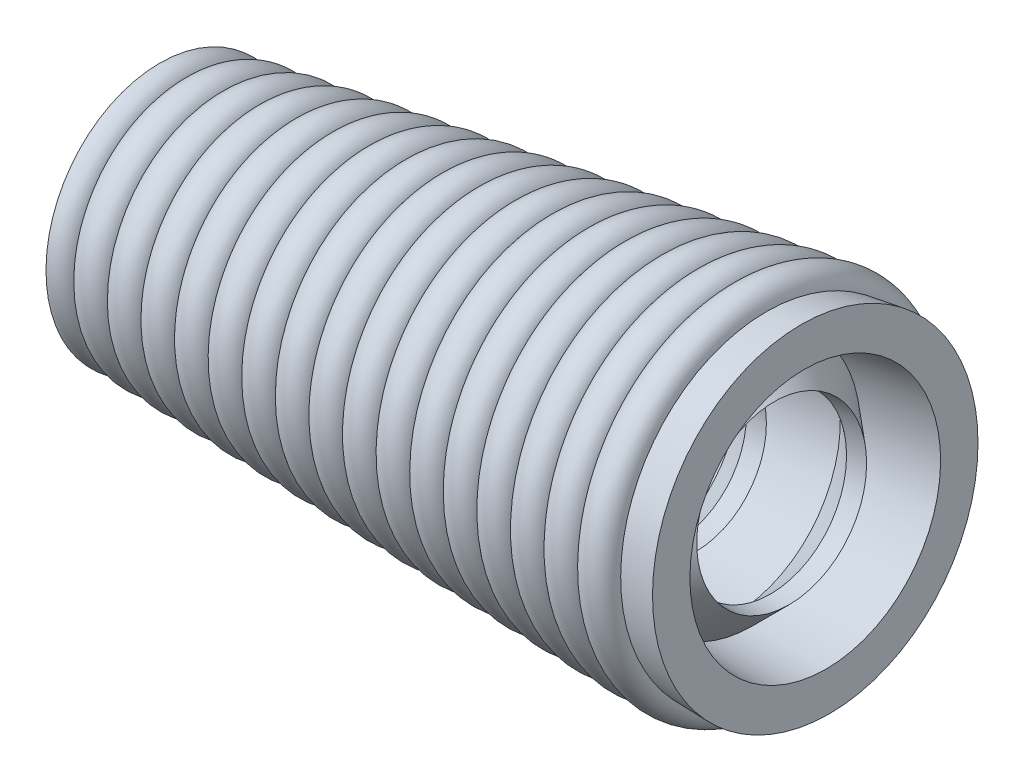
SolidWorks part; units mm, degrees
ref_plane "Front Plane" through (0, 0, 0) normal (0, 0, 1) x (1, 0, 0)
ref_plane "Top Plane" through (0, 0, 0) normal (0, 1, 0) x (1, 0, 0)
ref_plane "Right Plane" through (0, 0, 0) normal (1, 0, 0) x (0, 0, -1)
sketch "Sketch1" plane through (0, 0, 0) normal (0, 0, 1) x (1, 0, 0)
  line L0 (0, 0) -> (97.5367, 0) construction
  line L1 (0, 0) -> (6.35, -6.35)
  line L2 (6.35, -6.35) -> (50.8, -6.35)
  line L4 (292.1, 0) -> (259.4617, 0)
  line L5 (0, 0) -> (0, 25.5554) construction
  line L6 (203.2, -6.35) -> (292.1, -6.35)
  line L7 (145.1617, 12.7) -> (145.1617, 0) construction
  line L8 (0, 6.35) -> (292.1, 6.35) construction
  line L9 (145.1617, 0) -> (151.5117, 6.35)
  line L11 (151.5117, 6.35) -> (154.6867, 6.35)
  line L12 (148.3367, 0) -> (154.6867, 6.35)
  line L13 (-11.1934, -0.9793) -> (308.0638, 26.9521) construction
  line L14 (129.2867, 0) -> (135.6367, 6.35)
  line L16 (132.4617, 0) -> (138.8117, 6.35)
  line L17 (135.6367, 6.35) -> (138.8117, 6.35)
  line L18 (113.4117, 0) -> (119.7617, 6.35)
  line L20 (116.5867, 0) -> (122.9367, 6.35)
  line L21 (119.7617, 6.35) -> (122.9367, 6.35)
  line L22 (97.5367, 0) -> (103.8867, 6.35)
  line L24 (100.7117, 0) -> (107.0617, 6.35)
  line L25 (103.8867, 6.35) -> (107.0617, 6.35)
  line L26 (161.0367, 0) -> (167.3867, 6.35)
  line L28 (164.2117, 0) -> (170.5617, 6.35)
  line L29 (167.3867, 6.35) -> (170.5617, 6.35)
  line L30 (176.9117, 0) -> (183.2617, 6.35)
  line L32 (180.0867, 0) -> (186.4367, 6.35)
  line L33 (183.2617, 6.35) -> (186.4367, 6.35)
  line L34 (192.7867, 0) -> (199.1367, 6.35)
  line L36 (195.9617, 0) -> (202.3117, 6.35)
  line L37 (199.1367, 6.35) -> (202.3117, 6.35)
  line L38 (208.6617, 0) -> (215.0117, 6.35)
  line L40 (211.8367, 0) -> (218.1867, 6.35)
  line L41 (215.0117, 6.35) -> (218.1867, 6.35)
  line L42 (224.5367, 0) -> (230.8867, 6.35)
  line L44 (227.7117, 0) -> (234.0617, 6.35)
  line L45 (230.8867, 6.35) -> (234.0617, 6.35)
  line L46 (240.4117, 0) -> (246.7617, 6.35)
  line L48 (243.5867, 0) -> (249.9367, 6.35)
  line L49 (246.7617, 6.35) -> (249.9367, 6.35)
  line L50 (256.2867, 0) -> (262.6367, 6.35)
  line L52 (259.4617, 0) -> (265.8117, 6.35)
  line L53 (262.6367, 6.35) -> (265.8117, 6.35)
  line L54 (29.792, 5.7936) -> (85.7641, 10.6905) construction
  line L55 (100.7117, 0) -> (113.4117, 0) construction
  line L56 (97.5367, 0) -> (0, 0)
  line L58 (113.4117, 0) -> (100.7117, 0)
  line L59 (116.5867, 0) -> (129.2867, 0) construction
  line L60 (291.396, -1.1111) -> (312.3584, -1.1111) construction
  line L61 (129.2867, 0) -> (116.5867, 0)
  line L62 (132.4617, 0) -> (145.1617, 0) construction
  line L63 (145.1617, 0) -> (132.4617, 0)
  line L64 (148.3367, 0) -> (161.0367, 0) construction
  line L65 (164.2117, 0) -> (176.9117, 0) construction
  line L66 (161.0367, 0) -> (148.3367, 0)
  line L67 (176.9117, 0) -> (164.2117, 0)
  line L68 (180.0867, 0) -> (192.7867, 0) construction
  line L69 (192.7867, 0) -> (180.0867, 0)
  line L70 (195.9617, 0) -> (208.6617, 0) construction
  line L71 (208.6617, 0) -> (195.9617, 0)
  line L72 (211.8367, 0) -> (224.5367, 0) construction
  line L73 (224.5367, 0) -> (211.8367, 0)
  line L74 (227.7117, 0) -> (240.4117, 0) construction
  line L75 (240.4117, 0) -> (227.7117, 0)
  line L76 (243.5867, 0) -> (256.2867, 0) construction
  line L77 (256.2867, 0) -> (243.5867, 0)
  line L78 (259.4617, 0) -> (292.1, 0) construction
  line L79 (292.1, 0) -> (304.8, -1.1111)
  line L81 (292.1, 0) -> (292.1, 25.5554) construction
  line L82 (292.1, -6.35) -> (304.8, -1.1111)
  line L83 (292.1, 0) -> (292.1, -25.2445) construction
  arc A0 (57.15, -6.35) -> (50.8, -6.35) centre (53.975, -6.35) cw
  arc A1 (63.5, -6.35) -> (57.15, -6.35) centre (60.325, -6.35) cw
  arc A2 (69.85, -6.35) -> (63.5, -6.35) centre (66.675, -6.35) cw
  arc A3 (76.2, -6.35) -> (69.85, -6.35) centre (73.025, -6.35) cw
  arc A4 (82.55, -6.35) -> (76.2, -6.35) centre (79.375, -6.35) cw
  arc A5 (88.9, -6.35) -> (82.55, -6.35) centre (85.725, -6.35) cw
  arc A6 (95.25, -6.35) -> (88.9, -6.35) centre (92.075, -6.35) cw
  arc A7 (101.6, -6.35) -> (95.25, -6.35) centre (98.425, -6.35) cw
  arc A8 (107.95, -6.35) -> (101.6, -6.35) centre (104.775, -6.35) cw
  arc A9 (114.3, -6.35) -> (107.95, -6.35) centre (111.125, -6.35) cw
  arc A10 (120.65, -6.35) -> (114.3, -6.35) centre (117.475, -6.35) cw
  arc A11 (127, -6.35) -> (120.65, -6.35) centre (123.825, -6.35) cw
  arc A12 (133.35, -6.35) -> (127, -6.35) centre (130.175, -6.35) cw
  arc A13 (139.7, -6.35) -> (133.35, -6.35) centre (136.525, -6.35) cw
  arc A14 (146.05, -6.35) -> (139.7, -6.35) centre (142.875, -6.35) cw
  arc A15 (152.4, -6.35) -> (146.05, -6.35) centre (149.225, -6.35) cw
  arc A16 (158.75, -6.35) -> (152.4, -6.35) centre (155.575, -6.35) cw
  arc A17 (165.1, -6.35) -> (158.75, -6.35) centre (161.925, -6.35) cw
  arc A18 (171.45, -6.35) -> (165.1, -6.35) centre (168.275, -6.35) cw
  arc A19 (177.8, -6.35) -> (171.45, -6.35) centre (174.625, -6.35) cw
  arc A20 (184.15, -6.35) -> (177.8, -6.35) centre (180.975, -6.35) cw
  arc A21 (190.5, -6.35) -> (184.15, -6.35) centre (187.325, -6.35) cw
  arc A22 (196.85, -6.35) -> (190.5, -6.35) centre (193.675, -6.35) cw
  arc A23 (203.2, -6.35) -> (196.85, -6.35) centre (200.025, -6.35) cw
  point P29 (145.1617, 6.35)
  dimension "D12" = 3.175
  dimension "D1" = 292.1
  dimension "D2" = 45
  dimension "D3" = 6.35
  dimension "D4" = 4
  dimension "D5" = 3.175
  dimension "D6" = 3.175
  dimension "D7" = 5
  dimension "D8" = 12.7
  dimension "D10" = 12.7
  dimension "D11" = 50.8
  dimension "D14" = 6.35
  dimension "D15" = 45
  dimension "D16" = 175
  dimension "D17" = 12.7
  dimension "D9" = 8
  dimension "D13" = 24
revolve "Revolve2" add sketch "Sketch1" angle 360 about L54
ref_plane "Plane1" through (96.7958, 8.4685, 0) normal (0.9962, 0.0872, 0) x (0, 0, -1)
ref_plane "Plane2" through (207.0766, 18.1169, 0) normal (0.9962, 0.0872, 0) x (0, 0, -1)
other "SurfaceCut4"
other "SurfaceCut5"
